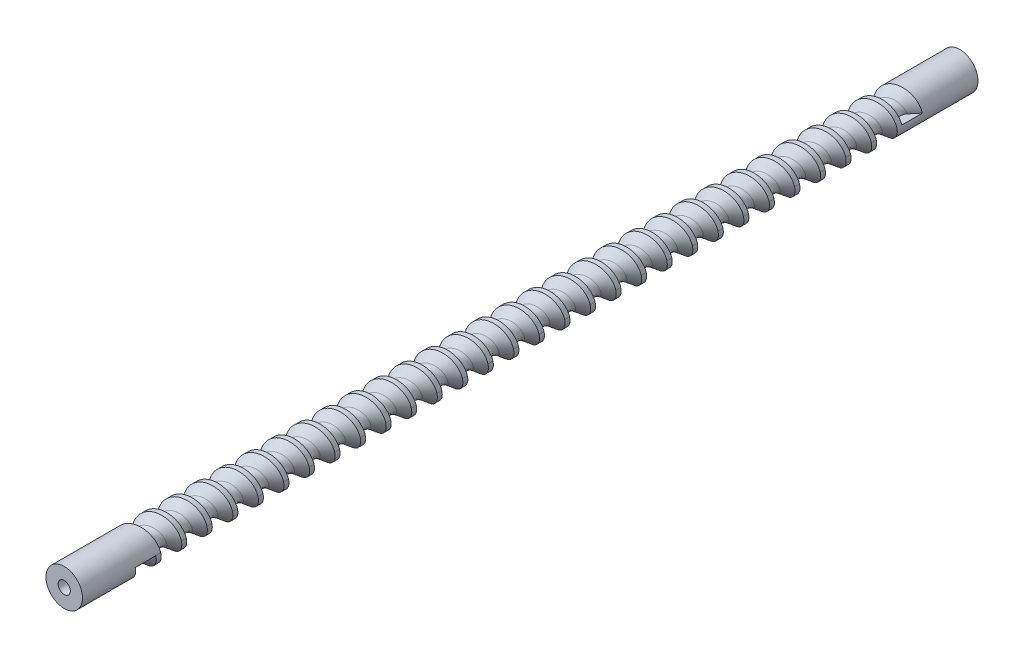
SolidWorks part; units mm, degrees
ref_plane "Front Plane" through (0, 0, 0) normal (0, 0, 1) x (1, 0, 0)
ref_plane "Top Plane" through (0, 0, 0) normal (0, 1, 0) x (1, 0, 0)
ref_plane "Right Plane" through (0, 0, 0) normal (1, 0, 0) x (0, 0, -1)
sketch "Sketch1" plane through (0, 0, 0) normal (0, 0, 1) x (1, 0, 0)
  circle A0 centre (0, 0) radius 15
  dimension "D1" = 30
extrude "Boss-Extrude1" add sketch "Sketch1" along normal blind 736
ref_plane "Plane1" through (0, 0, 686) normal (0, 0, 1) x (1, 0, 0)
sketch "Sketch2" plane through (0, 0, 686) normal (0, 0, 1) x (1, 0, 0)
  circle A1 centre (0, 0) radius 15
  circle A2 centre (0, 0) radius 15
  dimension "D1" = 0
curve "Helix/Spiral1"
sketch "Sketch3" plane through (0, 0, 0) normal (1, 0, 0) x (0, 0, -1)
  line L1 (-689.155, -25.1146) -> (-667.7875, -17.2208)
  line L2 (-667.7875, -17.2208) -> (-677.3145, -9.3045)
  line L3 (-687.0628, -12.9059) -> (-689.155, -25.1146)
  circle A0 centre (-680.75, -14.9994) radius 6.5757 construction
  arc A1 (-687.0628, -12.9059) -> (-677.3145, -9.3045) centre (-681.149, -13.9193) cw
  dimension "D1" = 6
sweep "Cut-Sweep1" cut profiles "Sketch3" path "Helix/Spiral1"
sketch "Sketch5" plane through (0, 0, 736) normal (0, 0, 1) x (1, 0, 0)
  circle A0 centre (0, 0) radius 5
  dimension "D1" = 10
extrude "Cut-Extrude1" cut sketch "Sketch5" against normal blind 10
